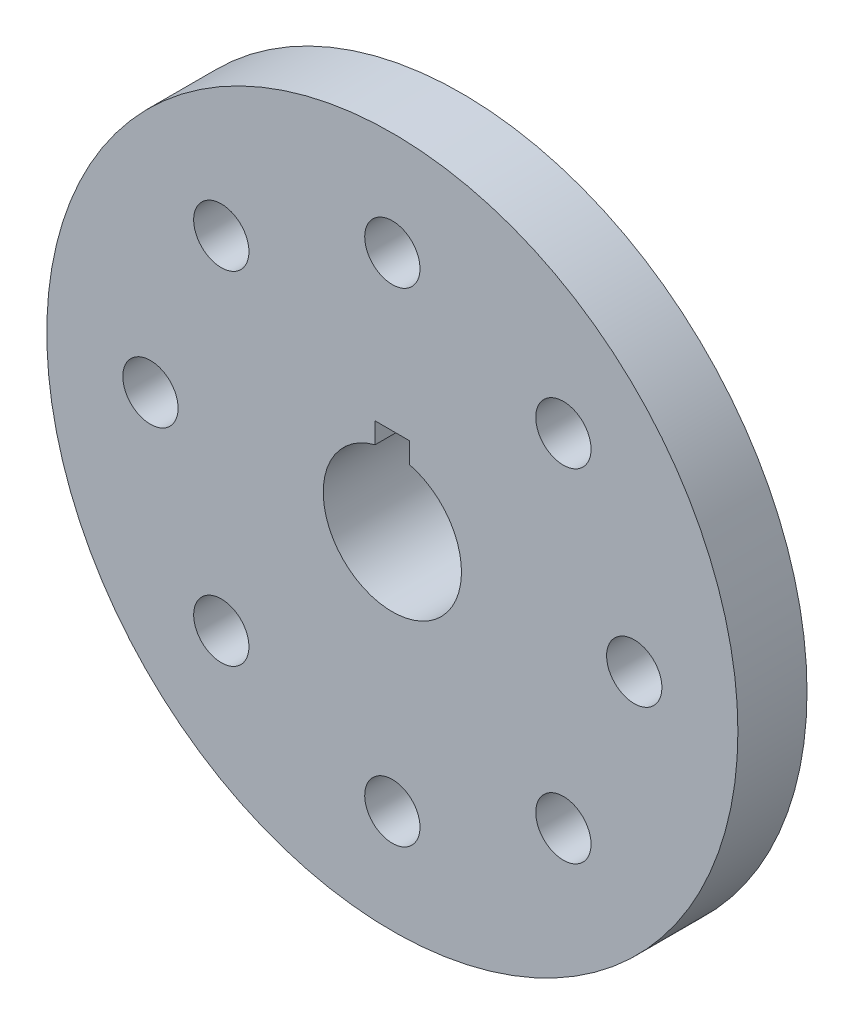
SolidWorks part; units mm, degrees
ref_plane "Front Plane" through (0, 0, 0) normal (0, 0, 1) x (1, 0, 0)
ref_plane "Top Plane" through (0, 0, 0) normal (0, 1, 0) x (1, 0, 0)
ref_plane "Right Plane" through (0, 0, 0) normal (1, 0, 0) x (0, 0, -1)
mirrored part "Flange_Mirrored"
other "<Flange>-<Cut-Extrude3>"
